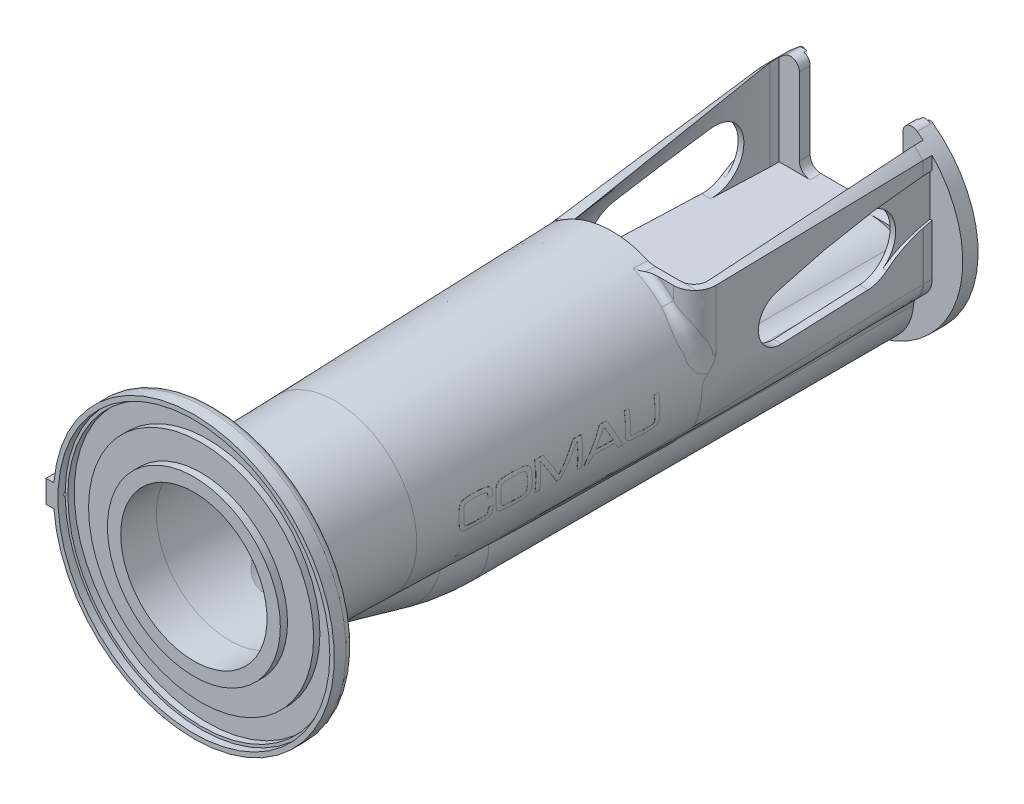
SolidWorks part; units mm, degrees
ref_plane "Piano1 (Front/Back)" through (0, 0, 0) normal (0, 0, 1) x (1, 0, 0)
ref_plane "Piano2 (Top/Bottom)" through (0, 0, 0) normal (0, 1, 0) x (1, 0, 0)
ref_plane "Piano3 (Left/Right)" through (0, 0, 0) normal (1, 0, 0) x (0, 0, -1)
imported_body "Importato1"
ref_plane "Piano1" through (-115, 0, 0) normal (1, 0, 0) x (0, 0, -1)
sketch "Schizzo1" plane through (-115, 0, 0) normal (-1, 0, 0) x (0, 0, 1)
  line L0 (-456.5, -15) -> (-148.6252, -15) construction
  line L1 (-456.5, -43.081) -> (-456.5, 72) construction
  line L2 (-148.6252, 90.9696) -> (-148.6252, -61.8036) construction
  text T0 "COMAU" font "MicrogrammaDMedExt" height 31.5
  dimension "D1" = 15
extrude "Estrusione1" add sketch "Schizzo1" against normal up to next
sketch "Schizzo2" plane through (-115, 0, 0) normal (-1, 0, 0) x (0, 0, 1)
  line L0 (-194.2544, 0.9253) -> (-194.2544, 16.5) construction
  line L1 (-411.8708, 18.5) -> (-189.2544, 18.5)
  line L2 (-411.8708, 18.5) -> (-411.8708, -17)
  line L3 (-411.8708, -17) -> (-189.2544, -17)
  line L4 (-189.2544, 18.5) -> (-189.2544, -17)
  line L5 (-199.4325, 16.5) -> (-194.2544, 16.5) construction
  line L6 (-238.6996, -15) -> (-233.0698, -15) construction
  point P6 (-196.8434, 16.5)
  dimension "D1" = 5
  dimension "D2" = 2
  dimension "D3" = 2
  dimension "D4" = 1
extrude "Taglio-Estrusione2" cut sketch "Schizzo2" against normal offset from surface (24.6125 mm away) 0.1
ref_plane "Piano2" through (115, 0, 0) normal (1, 0, 0) x (0, 0, -1)
sketch "Schizzo3" plane through (115, 0, 0) normal (1, 0, 0) x (0, 0, -1)
  line L0 (148.6252, -15) -> (456.4997, -15) construction
  line L1 (148.6252, -61.8036) -> (148.6252, 90.9696) construction
  line L2 (456.5, 0) -> (456.4992, -43.081) construction
  text T0 "COMAU" font "MicrogrammaDMedExt" height 31.5
  dimension "D1" = 15
extrude "Estrusione2" add sketch "Schizzo3" against normal up to next
sketch "Schizzo4" plane through (115, 0, 0) normal (1, 0, 0) x (0, 0, -1)
  line L0 (410.8707, 0.9253) -> (410.8707, 16.5) construction
  line L1 (192.2543, 18.5) -> (412.8707, 18.5)
  line L2 (192.2543, 18.5) -> (192.2543, -17)
  line L3 (192.2543, -17) -> (412.8707, -17)
  line L4 (412.8707, 18.5) -> (412.8707, -17)
  line L5 (405.6926, 16.5) -> (410.8707, 16.5) construction
  line L6 (327.5899, -15) -> (322.4118, -15) construction
  point P6 (408.2816, 16.5)
  point P9 (325.0008, -15)
  dimension "D1" = 2
  dimension "D2" = 2
  dimension "D3" = 2
  dimension "D4" = 2
extrude "Taglio-Estrusione3" cut sketch "Schizzo4" against normal offset from surface (17.9268 mm away) 0.1
